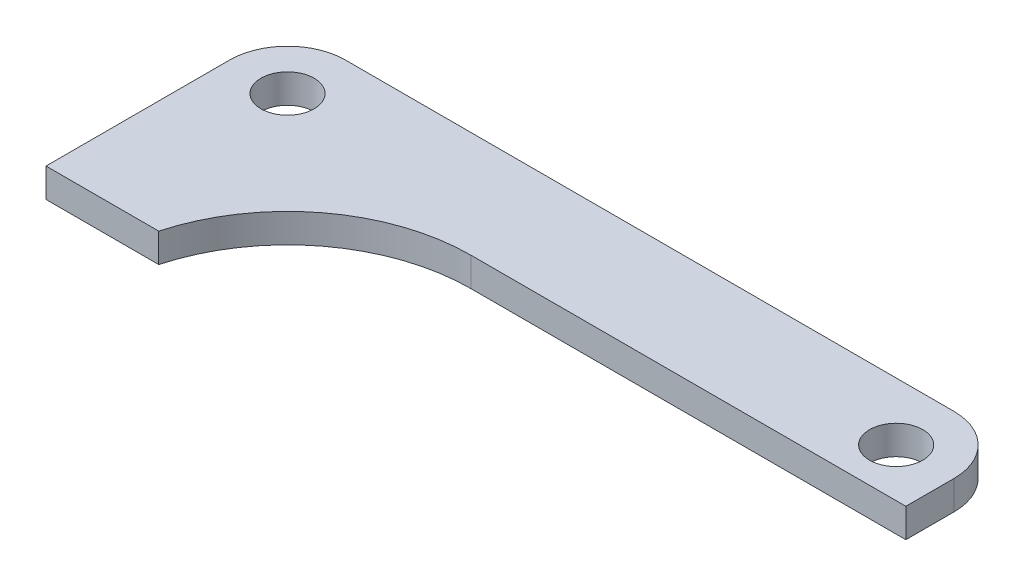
SolidWorks part; units mm, degrees
ref_plane "Front" through (0, 0, 0) normal (0, 0, 1) x (1, 0, 0)
ref_plane "Top" through (0, 0, 0) normal (0, 1, 0) x (1, 0, 0)
ref_plane "Right" through (0, 0, 0) normal (1, 0, 0) x (0, 0, -1)
sketch "Sketch1" plane through (0, 0, 0) normal (0, 1, 0) x (1, 0, 0)
  line L0 (30, 14) -> (75, 14)
  line L1 (0, 0) -> (11.6697, 0)
  line L2 (0, 0) -> (0, 19)
  line L3 (6, 25) -> (69, 25)
  line L4 (75, 14) -> (75, 19)
  line L5 (0, 14) -> (75, 14) construction
  line L6 (0, 25) -> (75, 25) construction
  circle A0 centre (6, 19) radius 2.75
  circle A1 centre (69, 19) radius 2.75
  arc A2 (30, 14) -> (11.6697, 0) centre (30, -5) ccw
  arc A3 (0, 19) -> (6, 25) centre (6, 19) cw
  arc A4 (75, 19) -> (69, 25) centre (69, 19) ccw
  dimension "D1" = 5.5
  dimension "D2" = 5.5
  dimension "D3" = 19
extrude "Extrude1" add sketch "Sketch1" along normal blind 3
